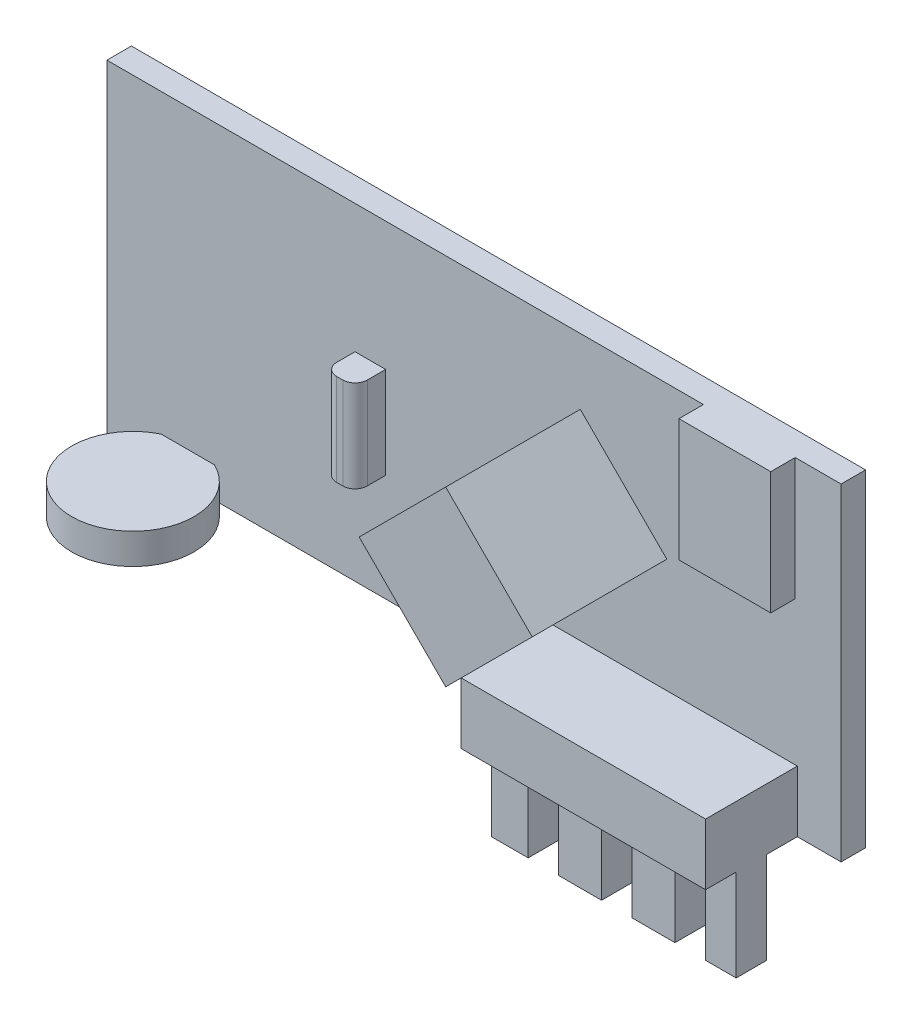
SolidWorks part; units mm, degrees
ref_plane "Front Plane" through (0, 0, 0) normal (0, 0, 1) x (1, 0, 0)
ref_plane "Top Plane" through (0, 0, 0) normal (0, 1, 0) x (1, 0, 0)
ref_plane "Right Plane" through (0, 0, 0) normal (1, 0, 0) x (0, 0, -1)
sketch "Sketch1" plane through (0, 0, 0) normal (0, 0, 1) x (1, 0, 0)
  line L1 (0, 0) -> (30.48, 0)
  line L2 (0, 0) -> (0, 13.589)
  line L3 (0, 13.589) -> (30.48, 13.589)
  line L4 (30.48, 0) -> (30.48, 13.589)
  dimension "D1" = 30.48
  dimension "D2" = 13.589
extrude "Boss-Extrude1" add sketch "Sketch1" along normal blind 1.016
sketch "Sketch2" plane through (0, 0, 1.016) normal (0, 0, 1) x (1, 0, 0)
  line L0 (30.48, 13.589) -> (0, 13.589) construction
  line L1 (24.765, 13.589) -> (28.575, 13.589)
  line L2 (24.765, 13.589) -> (24.765, 8.509)
  line L3 (24.765, 8.509) -> (28.575, 8.509)
  line L4 (28.575, 13.589) -> (28.575, 8.509)
  line L5 (30.48, 0) -> (30.48, 13.589) construction
  dimension "D1" = 3.81
  dimension "D2" = 5.08
  dimension "D3" = 1.905
extrude "Boss-Extrude2" add sketch "Sketch2" along normal blind 1.016
sketch "Sketch3" plane through (0, 0, 1.016) normal (0, 0, 1) x (1, 0, 0)
  line L1 (19.6532, 3.6762) -> (23.2453, 7.2683)
  line L2 (23.2453, 7.2683) -> (19.6532, 10.8604)
  line L3 (19.6532, 10.8604) -> (16.0611, 7.2683)
  line L4 (16.0611, 7.2683) -> (19.6532, 3.6762)
  circle A0 centre (19.6532, 7.2683) radius 2.54 construction
  dimension "D1" = 5.08
extrude "Boss-Extrude3" add sketch "Sketch3" along normal blind 5.588
sketch "Sketch5" plane through (0, 0, 1.016) normal (0, 0, 1) x (1, 0, 0)
  line L0 (0, 0) -> (30.48, 0) construction
  line L1 (18.5037, -3.81) -> (28.6637, -3.81)
  line L2 (18.5037, -3.81) -> (18.5037, 2.54)
  line L3 (18.5037, 2.54) -> (28.6637, 2.54)
  line L4 (28.6637, -3.81) -> (28.6637, 2.54)
  dimension "D1" = 6.35
  dimension "D2" = 2.54
  dimension "D3" = 10.16
extrude "Boss-Extrude4" add sketch "Sketch5" along normal blind 3.81
sketch "Sketch6" plane through (28.6637, 0, 0) normal (1, 0, 0) x (0, 0, -1)
  line L1 (-4.826, -3.81) -> (-3.556, -3.81)
  line L2 (-4.826, -3.81) -> (-4.826, 0)
  line L3 (-4.826, 0) -> (-3.556, 0)
  line L4 (-3.556, -3.81) -> (-3.556, 0)
  line L5 (-1.016, -3.81) -> (-2.286, -3.81)
  line L6 (-1.016, -3.81) -> (-1.016, 0)
  line L7 (-1.016, 0) -> (-2.286, 0)
  line L8 (-2.286, -3.81) -> (-2.286, 0)
  dimension "D1" = 1.27
  dimension "D2" = 1.27
extrude "Cut-Extrude1" cut sketch "Sketch6" against normal blind 14.224
sketch "Sketch7" plane through (0, 0, 3.556) normal (0, 0, 1) x (1, 0, 0)
  line L0 (18.5037, -3.81) -> (28.6637, -3.81) construction
  line L1 (20.0277, -3.81) -> (21.2977, -3.81)
  line L2 (20.0277, -3.81) -> (20.0277, 0)
  line L3 (20.0277, 0) -> (21.2977, 0)
  line L4 (21.2977, -3.81) -> (21.2977, 0)
  line L5 (18.5037, 0) -> (28.6637, 0) construction
  line L6 (23.0757, -3.81) -> (24.3457, -3.81)
  line L7 (23.0757, -3.81) -> (23.0757, 0)
  line L8 (23.0757, 0) -> (24.3457, 0)
  line L9 (24.3457, -3.81) -> (24.3457, 0)
  line L10 (18.5037, -3.81) -> (18.5037, 0) construction
  line L11 (26.1237, -3.81) -> (27.3937, -3.81)
  line L12 (26.1237, -3.81) -> (26.1237, 0)
  line L13 (26.1237, 0) -> (27.3937, 0)
  line L14 (27.3937, -3.81) -> (27.3937, 0)
  dimension "D1" = 1.27
  dimension "D2" = 1.27
  dimension "D3" = 1.27
  dimension "D4" = 1.524
  dimension "D5" = 1.778
  dimension "D6" = 1.778
extrude "Cut-Extrude2" cut sketch "Sketch7" against normal blind 14.224
sketch "Sketch9" plane through (0, 0, 0) normal (0, -1, 0) x (1, 0, 0)
  line L0 (0, 1.016) -> (18.5037, 1.016) construction
  circle A0 centre (3.3628, 3.302) radius 2.54
  dimension "D1" = 5.08
  dimension "D2" = 2.286
extrude "Boss-Extrude5" add sketch "Sketch9" against normal blind 1.27
sketch "Sketch10" plane through (0, 0, 1.016) normal (0, 0, 1) x (1, 0, 0)
  line L0 (4.47, 0) -> (18.5037, 0) construction
  line L1 (10.3009, 8.255) -> (11.5709, 8.255)
  line L2 (10.3009, 8.255) -> (10.3009, 4.445)
  line L3 (10.3009, 4.445) -> (11.5709, 4.445)
  line L4 (11.5709, 8.255) -> (11.5709, 4.445)
  line L5 (10.3009, 8.255) -> (11.5709, 4.445) construction
  line L6 (10.3009, 4.445) -> (11.5709, 8.255) construction
  point P0 (10.9359, 6.35)
  dimension "D1" = 1.27
  dimension "D2" = 3.81
  dimension "D3" = 6.35
extrude "Boss-Extrude6" add sketch "Sketch10" along normal blind 1.27
fillet "Fillet2" radius 0.508 2 edges at (10.3009, 6.35, 2.286) (11.5709, 6.35, 2.286)
